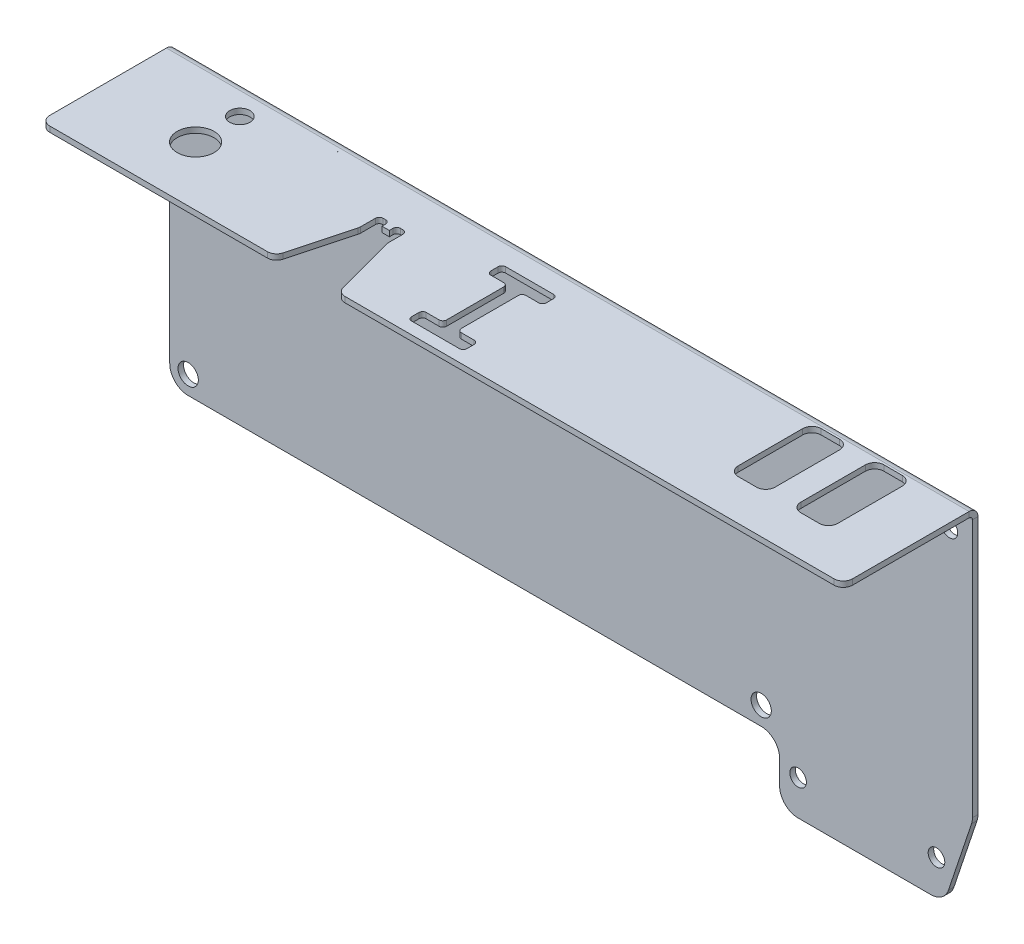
SolidWorks part; units mm, degrees
ref_plane "Plan1" through (0, 0, 0) normal (0, 0, 1) x (1, 0, 0)
ref_plane "Plan2" through (0, 0, 0) normal (0, 1, 0) x (1, 0, 0)
ref_plane "Plan3" through (0, 0, 0) normal (1, 0, 0) x (0, 0, -1)
sketch "Esquisse1" plane through (0, 0, 0) normal (0, 0, 1) x (1, 0, 0)
  line L0 (0, 157.1) -> (435, 157.1) construction
  line L1 (165.0744, 228.2) -> (180, 228.2)
  line L2 (0, 223.2) -> (0, 10)
  line L3 (10, 0) -> (320.5, 0)
  line L4 (52, 196.2) -> (52, 172.2) construction
  line L5 (136.5, 191.2) -> (136.5, 183.2)
  line L6 (138.5, 181.2) -> (140, 181.2)
  line L7 (5, 228.2) -> (122.9256, 228.2)
  line L8 (151.5, 191.2) -> (151.5, 183.2)
  line L9 (374.5, 10) -> (10, 10) construction
  line L10 (292.29, -14) -> (415.5, -14) construction
  line L11 (378, 44.3) -> (378, -33) construction
  line L12 (151.6704, 192.4941) -> (160.2447, 224.4941)
  line L13 (136.3296, 192.4941) -> (127.7553, 224.4941)
  line L14 (435, 223.2) -> (435, 14.3925)
  line L15 (412.4886, -33) -> (340.5, -33)
  line L16 (330.5, -10) -> (330.5, -23)
  line L17 (434.4832, 11.2195) -> (421.9719, -26.173)
  line L19 (148, 181.2) -> (149.5, 181.2)
  line L20 (180, 228.2) -> (430, 228.2)
  line L22 (378, 181) -> (378, 157.1) construction
  line L23 (144, 191.2) -> (144, 157.1) construction
  line L24 (156.5, 191.2) -> (131.5, 191.2) construction
  line L25 (204.7, 217.7) -> (240.1, 217.7) construction
  line L26 (213.5, 213.7) -> (220.5, 213.7)
  line L27 (203.5, 211.7) -> (203.5, 180.7)
  line L28 (222.5, 176.7) -> (222.5, 172.7)
  line L29 (211.5, 211.7) -> (211.5, 180.7)
  line L30 (194.5, 213.7) -> (201.5, 213.7)
  line L31 (146, 183.2) -> (146, 185.2)
  line L32 (146, 185.2) -> (142, 185.2)
  line L33 (390, 206.2) -> (400, 206.2)
  line L34 (385, 201.2) -> (385, 166.2)
  line L35 (390, 161.2) -> (400, 161.2)
  line L36 (405, 201.2) -> (405, 166.2)
  line L37 (356, 206.2) -> (366, 206.2)
  line L38 (351, 201.2) -> (351, 166.2)
  line L39 (356, 161.2) -> (366, 161.2)
  line L40 (371, 201.2) -> (371, 166.2)
  line L41 (142, 183.2) -> (142, 185.2)
  line L42 (192.5, 215.7) -> (192.5, 219.7)
  line L43 (194.5, 170.7) -> (220.5, 170.7)
  line L44 (194.5, 221.7) -> (220.5, 221.7)
  line L45 (222.5, 215.7) -> (222.5, 219.7)
  line L46 (192.5, 176.7) -> (192.5, 172.7)
  line L47 (194.5, 178.7) -> (201.5, 178.7)
  line L48 (213.5, 178.7) -> (220.5, 178.7)
  line L51 (212.9, 196.2) -> (229.6, 196.2) construction
  line L54 (207.5, 196.2) -> (207.5, 219.5295) construction
  arc A0 (320.5, 0) -> (330.5, -10) centre (320.5, -10) cw
  circle A1 centre (52, 172.2) radius 5.5
  circle A2 centre (52, 196.2) radius 10
  circle A3 centre (10, 10) radius 5.5
  circle A5 centre (340.5, -14) radius 4.5
  circle A6 centre (415.5, -14) radius 4.5
  arc A7 (434.4832, 11.2195) -> (435, 14.3925) centre (425, 14.3925) ccw
  arc A8 (412.4886, -33) -> (421.9719, -26.173) centre (412.4886, -23) ccw
  arc A10 (10, 0) -> (0, 10) centre (10, 10) cw
  arc A11 (340.5, -33) -> (330.5, -23) centre (340.5, -23) cw
  arc A12 (165.0744, 228.2) -> (160.2447, 224.4941) centre (165.0744, 223.2) ccw
  arc A13 (122.9256, 228.2) -> (127.7553, 224.4941) centre (122.9256, 223.2) cw
  arc A14 (0, 223.2) -> (5, 228.2) centre (5, 223.2) cw
  arc A15 (430, 228.2) -> (435, 223.2) centre (430, 223.2) cw
  arc A16 (151.6704, 192.4941) -> (151.5, 191.2) centre (156.5, 191.2) ccw
  arc A17 (136.3296, 192.4941) -> (136.5, 191.2) centre (131.5, 191.2) cw
  arc A18 (138.5, 181.2) -> (136.5, 183.2) centre (138.5, 183.2) cw
  circle A19 centre (422.5, 144) radius 4.5
  arc A20 (149.5, 181.2) -> (151.5, 183.2) centre (149.5, 183.2) ccw
  arc A21 (148, 181.2) -> (146, 183.2) centre (148, 183.2) cw
  arc A22 (351, 201.2) -> (356, 206.2) centre (356, 201.2) cw
  arc A23 (366, 206.2) -> (371, 201.2) centre (366, 201.2) cw
  arc A24 (211.5, 211.7) -> (213.5, 213.7) centre (213.5, 211.7) cw
  arc A25 (201.5, 213.7) -> (203.5, 211.7) centre (201.5, 211.7) cw
  arc A26 (192.5, 215.7) -> (194.5, 213.7) centre (194.5, 215.7) ccw
  arc A27 (194.5, 221.7) -> (192.5, 219.7) centre (194.5, 219.7) ccw
  arc A28 (356, 161.2) -> (351, 166.2) centre (356, 166.2) cw
  arc A29 (371, 166.2) -> (366, 161.2) centre (366, 166.2) cw
  arc A30 (385, 201.2) -> (390, 206.2) centre (390, 201.2) cw
  arc A31 (390, 161.2) -> (385, 166.2) centre (390, 166.2) cw
  arc A32 (405, 166.2) -> (400, 161.2) centre (400, 166.2) cw
  arc A33 (400, 206.2) -> (405, 201.2) centre (400, 201.2) cw
  arc A34 (140, 181.2) -> (142, 183.2) centre (140, 183.2) ccw
  circle A35 centre (320.5, 10) radius 5.5
  arc A36 (222.5, 219.7) -> (220.5, 221.7) centre (220.5, 219.7) ccw
  arc A37 (220.5, 213.7) -> (222.5, 215.7) centre (220.5, 215.7) ccw
  arc A38 (220.5, 178.7) -> (222.5, 176.7) centre (220.5, 176.7) cw
  arc A39 (222.5, 172.7) -> (220.5, 170.7) centre (220.5, 172.7) cw
  arc A40 (194.5, 170.7) -> (192.5, 172.7) centre (194.5, 172.7) cw
  arc A41 (192.5, 176.7) -> (194.5, 178.7) centre (194.5, 176.7) cw
  arc A42 (201.5, 178.7) -> (203.5, 180.7) centre (201.5, 180.7) ccw
  arc A43 (211.5, 180.7) -> (213.5, 178.7) centre (213.5, 180.7) ccw
  point P35 (435, -33)
  point P42 (0, 0)
  point P45 (330.5, -33)
  point P52 (0, 228.2)
  point P55 (435, 228.2)
  point P60 (151.5, 191.8583)
  point P63 (136.5, 191.8583)
  point P76 (136.5, 181.2)
  point P79 (151.5, 181.2)
  point P100 (203.5, 196.2)
  point P154 (211.5, 196.2)
  dimension "D5" = 9
  dimension "D8" = 11
  dimension "D14" = 20
  dimension "D15" = 134
  dimension "D23" = 71.5
  dimension "D25" = 10
  dimension "D28" = 4
  dimension "D29" = 10
  dimension "D30" = 15
  dimension "D31" = 5
  dimension "D33" = 4
  dimension "D34" = 5
  dimension "D35" = 5
  dimension "D36" = 2
  dimension "D37" = 8
  dimension "D6" = 10
  dimension "D39" = 14
  dimension "D43" = 8
  dimension "D7" = 11
  dimension "D46" = 10
  dimension "D45" = 21.5
  dimension "D52" = 5
  dimension "D17" = 12.5
  dimension "D48" = 32
  dimension "D54" = 9
  dimension "D53" = 2
  dimension "D1" = 435
  dimension "D2" = 71.1
  dimension "D3" = 32
  dimension "D4" = 104.5
  dimension "D9" = 52
  dimension "D10" = 47
  dimension "D11" = 15
  dimension "D12" = 144
  dimension "D13" = 56
  dimension "D16" = 10
  dimension "D18" = 10
  dimension "D19" = 19
  dimension "D21" = 57
  dimension "D22" = 75
  dimension "D24" = 261.2
  dimension "D32" = 10
  dimension "D38" = 22
  dimension "D40" = 20
  dimension "D41" = 57
  dimension "D42" = 30
  dimension "D44" = 207.5
  dimension "D47" = 147.1
  dimension "D49" = 20
  dimension "D50" = 30
  dimension "D51" = 45
extrude "Base-Extrusion" add sketch "Esquisse1" along normal blind 3
sheet metal parameters "Tôlerie 2" parameters "D1"=3
flatten bends "Dépliage 2" parameters "D1"=3
sketch "Esquisse-Angle2" plane through (0, 0, 3) normal (0, 0, 1) x (1, 0, 0)
process bends "Pliage 2" parameters "D1"=1.8
sketch "Esquisse-Plate2" plane through (0, 0, 3) normal (0, 0, 1) x (1, 0, 0)
  line L0 (-30, 157.1) -> (471.5974, 157.1)
  line L1 (430, 228.2) -> (165.0744, 228.2) construction
  line L2 (430, 228.2) -> (165.0744, 228.2) construction
  circle A1 centre (52, 172.2) radius 5.5 construction
  point P2 (217.5, 70.1)
  dimension "D2" = 15.1
  dimension "D1" = 71.1
bend "Pli défini à plat1" bend radius 1.8 bend angle 90 parameters "D5"=1
